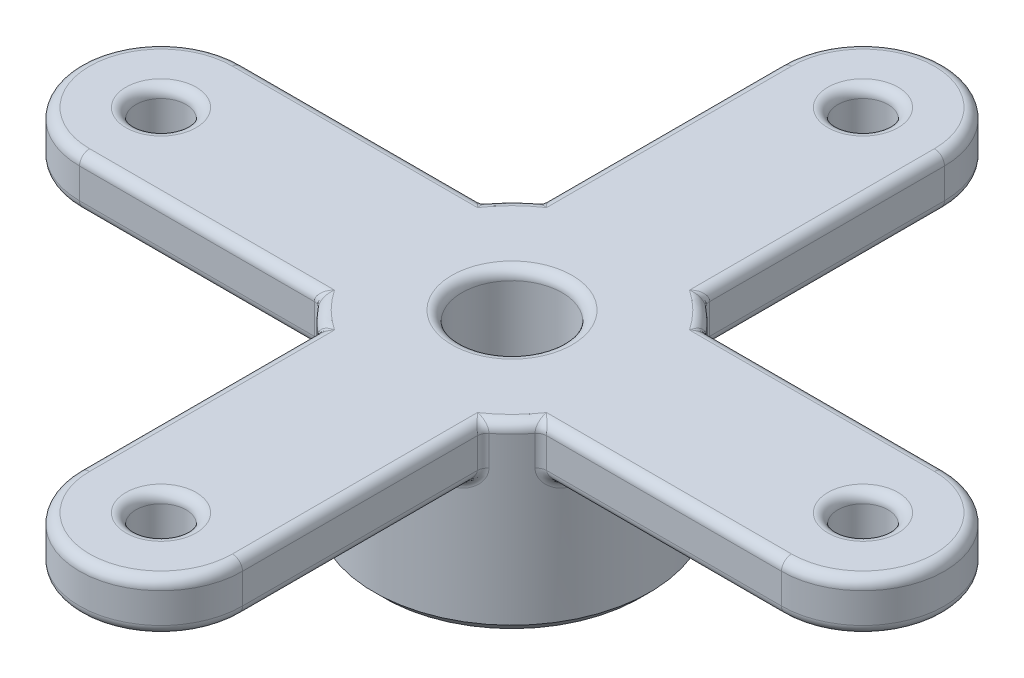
SolidWorks part; units mm, degrees
ref_plane "Vorne" through (0, 0, 0) normal (0, 0, 1) x (1, 0, 0)
ref_plane "Oben" through (0, 0, 0) normal (0, 1, 0) x (1, 0, 0)
ref_plane "Rechts" through (0, 0, 0) normal (1, 0, 0) x (0, 0, -1)
sketch "Skizze1" plane through (0, 0, 0) normal (0, 1, 0) x (1, 0, 0)
  line L0 (-1.625, 7) -> (-1.625, 2.2185)
  line L1 (1.625, 7) -> (1.625, 2.2185)
  line L2 (0, -1000) -> (0, 49000) construction
  line L3 (-1000, 0) -> (49000, 0) construction
  line L4 (7, -1.625) -> (2.2185, -1.625)
  line L5 (7, 1.625) -> (2.2185, 1.625)
  line L6 (-1.625, -7) -> (-1.625, -2.2185)
  line L7 (1.625, -7) -> (1.625, -2.2185)
  line L8 (-7, 1.625) -> (-2.2185, 1.625)
  line L9 (-7, -1.625) -> (-2.2185, -1.625)
  circle A0 centre (0, 0) radius 1
  arc A1 (1.625, -2.2185) -> (2.2185, -1.625) centre (0, 0) ccw
  arc A2 (-1.625, 7) -> (1.625, 7) centre (0, 7) cw
  arc A3 (7, 1.625) -> (7, -1.625) centre (7, 0) cw
  arc A4 (1.625, -7) -> (-1.625, -7) centre (0, -7) cw
  arc A5 (-7, -1.625) -> (-7, 1.625) centre (-7, 0) cw
  arc A6 (-2.2185, -1.625) -> (-1.625, -2.2185) centre (0, 0) ccw
  arc A7 (-1.625, 2.2185) -> (-2.2185, 1.625) centre (0, 0) ccw
  arc A8 (2.2185, 1.625) -> (1.625, 2.2185) centre (0, 0) ccw
  circle A9 centre (0, 7) radius 0.5
  circle A10 centre (7, 0) radius 0.5
  circle A11 centre (0, -7) radius 0.5
  circle A12 centre (-7, 0) radius 0.5
  dimension "D1" = 2
  dimension "D2" = 5.5
  dimension "D5" = 1
  dimension "D3" = 3.25
  dimension "D4" = 7
extrude "Linear austragen1" add sketch "Skizze1" along normal blind 1
sketch "Skizze2" plane through (0, 0, 0) normal (0, -1, 0) x (1, 0, 0)
  circle A0 centre (0, 0) radius 1
  circle A1 centre (0, 0) radius 2.75
  arc A2 (1.625, -2.2185) -> (2.2185, -1.625) centre (0, 0) ccw construction
  circle A3 centre (0, 0) radius 1 construction
extrude "Linear austragen2" add sketch "Skizze2" along normal blind 2.7
chamfer "Fase1" distance 0.2 angle 45 1 edges at (0, -2.7, -2.75)
fillet "Verrundung1" radius 0.2 21 edges at (-7, 1, 0.5) (7, 1, 0.5) (0, 1, 1) (1.625, 1, -4.6093) (1.9445, 1, -1.9445) (4.6093, 1, -1.625) (8.625, 1, 0) (4.6093, 1, 1.625) (1.9445, 1, 1.9445) (1.625, 1, 4.6093) (0, 1, 8.625) (-1.625, 1, 4.6093) (-1.9445, 1, 1.9445) (-4.6093, 1, 1.625) (-8.625, 1, 0) (-4.6093, 1, -1.625) (-1.9445, 1, -1.9445) (-1.625, 1, -4.6093) (0, 1, -8.625) (0, 1, -6.5) (0, 1, 7.5)
fillet "Verrundung2" radius 0.2 36 edges at (-2.2001, 0.9148, -1.5888) (-2.2001, 0.9148, 1.5888) (1.5888, 0.9148, -2.2001) (-1.5888, 0.9148, -2.2001) (2.2001, 0.9148, 1.5888) (2.2001, 0.9148, -1.5888) (-1.5888, 0.9148, 2.2001) (1.5888, 0.9148, 2.2001) (-7, 0, 0.5) (-8.625, 0, 0) (0, 0, -6.5) (0, 0, -8.625) (7, 0, 0.5) (8.625, 0, 0) (0, 0, 7.5) (0, 0, 8.625)
